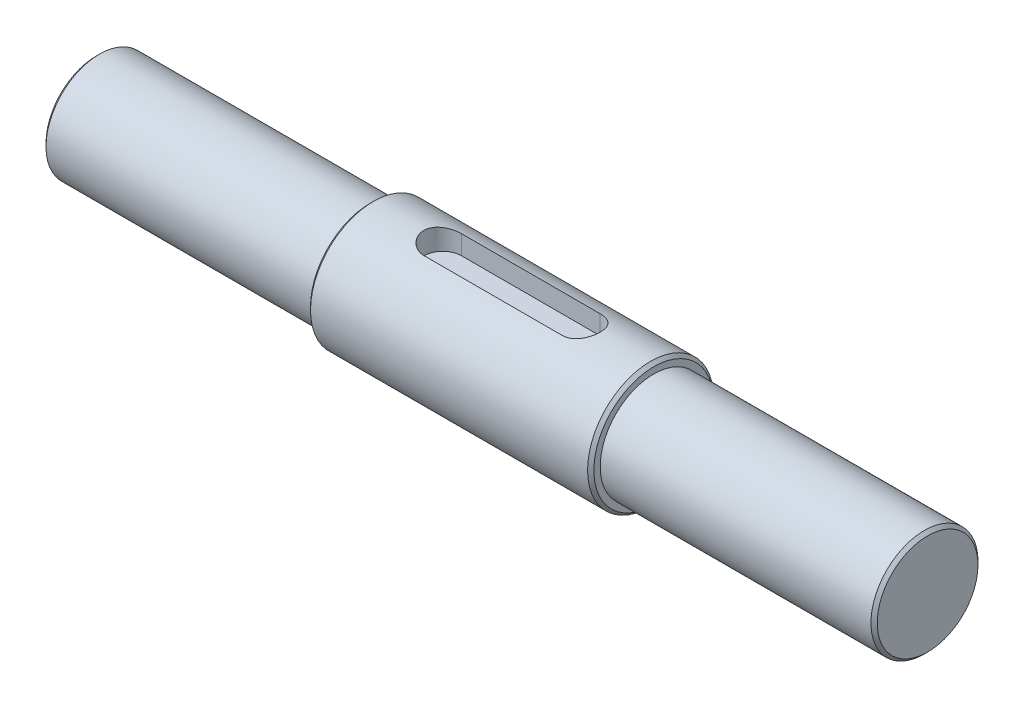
SolidWorks part; units mm, degrees
ref_plane "Front Plane" through (0, 0, 0) normal (0, 0, 1) x (1, 0, 0)
ref_plane "Top Plane" through (0, 0, 0) normal (0, 1, 0) x (1, 0, 0)
ref_plane "Right Plane" through (0, 0, 0) normal (1, 0, 0) x (0, 0, -1)
ref_plane "Plane1" through (0, 0, 0) normal (0, 0, -1) x (-1, 0, 0)
sketch "Sketch1" plane through (0, 0, 0) normal (0, 0, -1) x (-1, 0, 0)
  line L0 (-88.5, 10) -> (-88.5, 0)
  line L1 (-88.5, 0) -> (-43.5, 0)
  line L2 (-43.5, 0) -> (-43.5, 10)
  line L3 (-43.5, 10) -> (-88.5, 10)
  line L4 (-88.5, 0) -> (-43.5, 0) construction
  dimension "D1" = 45
  dimension "D2" = 10
revolve "Revolve1" add sketch "Sketch1" angle 360 about L4
sketch "Sketch2" plane through (43.5, 0, 0) normal (-1, 0, 0) x (0, 0, 1)
  circle A0 centre (0, 0) radius 8.5
  dimension "D1" = 17
extrude "Boss-Extrude1" add sketch "Sketch2" along normal blind 43.5
sketch "Sketch3" plane through (88.5, 0, 0) normal (1, 0, 0) x (0, 0, -1)
  circle A0 centre (0, 0) radius 8.5
  dimension "D1" = 17
extrude "Boss-Extrude2" add sketch "Sketch3" along normal blind 43.5
ref_plane "Plane2" through (0, 6.5, 0) normal (0, -1, 0) x (1, 0, 0)
sketch "Sketch4" plane through (0, 6.5, 0) normal (0, -1, 0) x (1, 0, 0)
  line L0 (77, 3) -> (55, 3)
  line L1 (55, -3) -> (77, -3)
  arc A0 (77, -3) -> (77, 3) centre (77, 0) ccw
  arc A1 (55, 3) -> (55, -3) centre (55, 0) ccw
  dimension "D1" = 3
  dimension "D2" = 22
chamfer "Chamfer1" distance 0.5 angle 45 4 edges at (88.5, 0, 10) (43.5, 0, 10) (0, 0, 8.5) (132, 0, -8.5)
extrude "Cut-Extrude2" cut sketch "Sketch4" against normal blind 10
